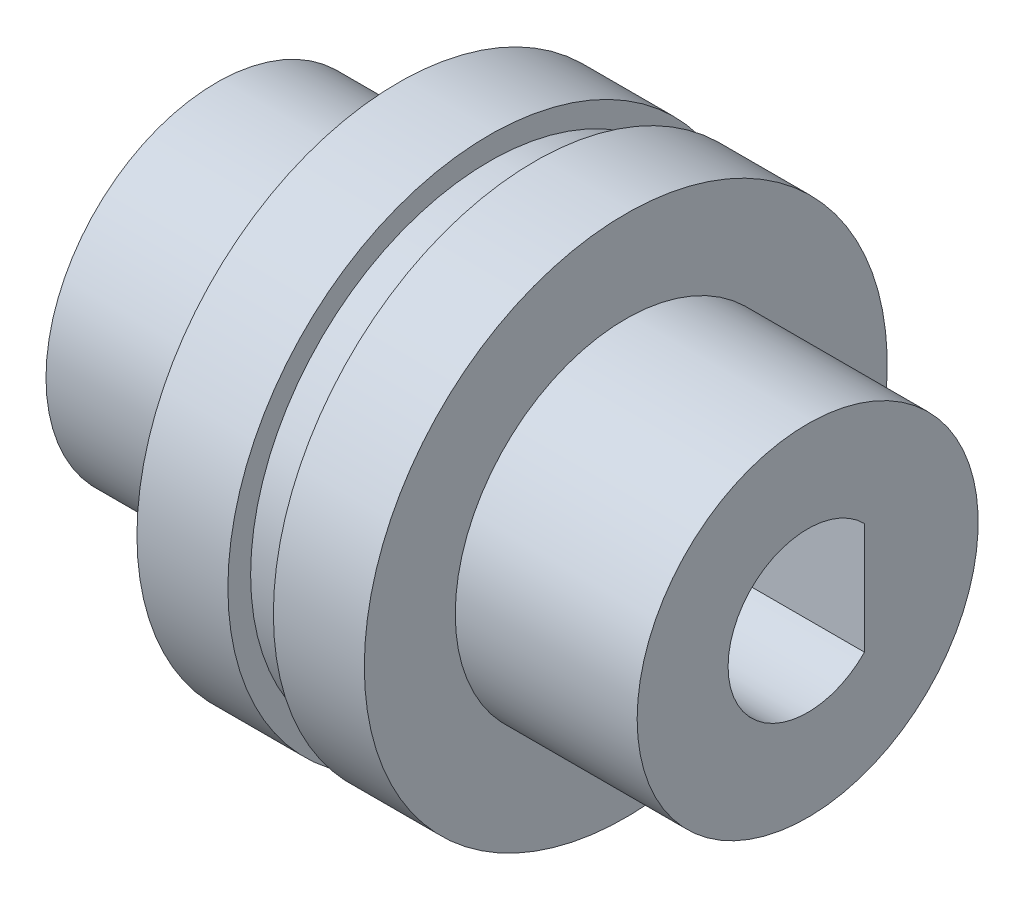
SolidWorks part; units mm, degrees
ref_plane "front" through (0, 0, 0) normal (0, 0, 1) x (1, 0, 0)
ref_plane "top" through (0, 0, 0) normal (0, 1, 0) x (1, 0, 0)
ref_plane "side" through (0, 0, 0) normal (1, 0, 0) x (0, 0, -1)
sketch "Sketch1" plane through (0, 0, 0) normal (0, 0, 1) x (1, 0, 0)
  line L0 (0, 0) -> (65.5339, 0) construction
  line L1 (0, 11.1125) -> (0, 23.8125)
  line L2 (0, 23.8125) -> (25.4, 23.8125)
  line L3 (25.4, 23.8125) -> (25.4, 36.5125)
  line L4 (25.4, 36.5125) -> (38.1, 36.5125)
  line L5 (38.1, 36.5125) -> (38.1, 33.3375)
  line L6 (38.1, 33.3375) -> (44.45, 33.3375)
  line L7 (41.275, 33.3375) -> (41.275, 0) construction
  line L8 (0, 11.1125) -> (82.55, 11.1125)
  line L9 (0, -50) -> (0, 50) construction
  line L10 (44.45, 36.5125) -> (44.45, 33.3375)
  line L11 (57.15, 36.5125) -> (44.45, 36.5125)
  line L12 (57.15, 23.8125) -> (57.15, 36.5125)
  line L13 (82.55, 23.8125) -> (57.15, 23.8125)
  line L14 (82.55, 11.1125) -> (82.55, 23.8125)
  point P15 (41.275, 11.1125)
  point P16 (41.275, 33.3375)
  dimension "D1" = 12.7
  dimension "D2" = 12.7
  dimension "D3" = 22.225
  dimension "D4" = 3.175
  dimension "D5" = 25.4
  dimension "D6" = 38.1
  dimension "D7" = 3.175
revolve "Base-Revolve" add sketch "Sketch1" angle 360 about L0
sketch "Sketch2" plane through (0, 0, 0) normal (1, 0, 0) x (0, 0, -1)
  line L0 (7.9375, 7.7771) -> (7.9375, -7.7771)
  circle A1 centre (0, 0) radius 11.1125 construction
  arc A2 (7.9375, -7.7771) -> (7.9375, 7.7771) centre (0, 0) ccw
  dimension "D1" = 3.175
extrude "Extrude1" add sketch "Sketch2" along normal through all
